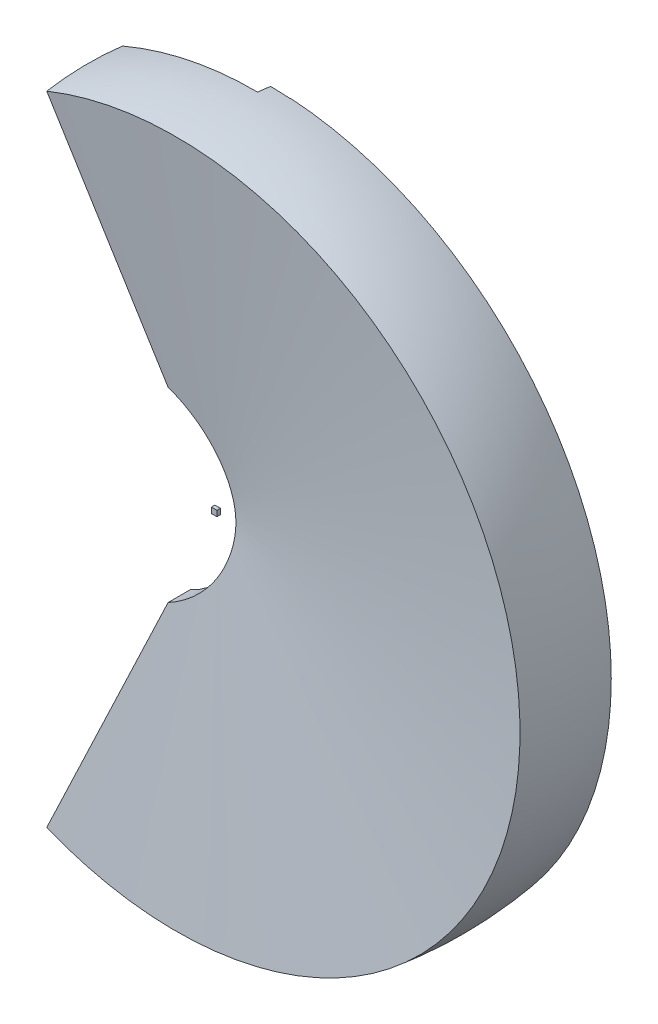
SolidWorks part; units mm, degrees
ref_plane "Piano frontale" through (0, 0, 0) normal (0, 0, 1) x (1, 0, 0)
ref_plane "Piano superiore" through (0, 0, 0) normal (0, 1, 0) x (1, 0, 0)
ref_plane "Piano destro" through (0, 0, 0) normal (1, 0, 0) x (0, 0, -1)
sketch "Schizzo1" plane through (0, 0, 0) normal (0, 0, 1) x (1, 0, 0)
  line L1 (-32.5, 32.5) -> (32.5, 32.5)
  line L2 (-32.5, 32.5) -> (-32.5, -32.5)
  line L3 (-32.5, -32.5) -> (32.5, -32.5)
  line L4 (32.5, 32.5) -> (32.5, -32.5)
  line L5 (-32.5, 32.5) -> (32.5, -32.5) construction
  line L6 (-32.5, -32.5) -> (32.5, 32.5) construction
  point P0 (0, 0)
  dimension "D1" = 65
extrude "Estrusione-Estrusione1" add sketch "Schizzo1" along normal blind 39.5
ref_plane "Piano1" through (0, 0, -60.5) normal (0, 0, -1) x (-1, 0, 0)
ref_plane "Piano2" through (0, 0, -585.3) normal (0, 0, -1) x (-1, 0, 0)
ref_plane "Piano3" through (-202.66, 0, 0) normal (-1, 0, 0) x (0, 0, 1)
ref_plane "Piano4" through (0, -500, 0) normal (0, -1, 0) x (-1, 0, 0)
ref_plane "Piano7" through (0, 0, 139.5) normal (0, 0, 1) x (1, 0, 0)
ref_plane "Piano5" through (32.5, 0, 0) normal (1, 0, 0) x (0, 0, -1)
sketch "Schizzo2" plane through (0, 0, 0) normal (0, 1, 0) x (1, 0, 0)
  line L0 (0, 0) -> (0, 20.5)
  line L1 (0, 20.5) -> (12.48, 20.5)
  line L2 (0, 0) -> (24, 0)
  line L3 (32.5, 0) -> (-32.5, 0) construction
  line L5 (32.5, -39.5) -> (-32.5, -39.5) construction
  arc A0 (24, 0) -> (12.48, 20.5) centre (0, 0) ccw
  dimension "D1" = 60
  dimension "D2" = 24
revolve "Rivoluzione1" add sketch "Schizzo2" angle 360 about L0
sketch "Schizzo4" plane through (0, 0, 0) normal (0, 1, 0) x (1, 0, 0)
  line L0 (32.5, -39.5) -> (-32.5, -39.5) construction
  line L1 (0, -992.5) -> (0, 49007.5) construction
  point P0 (0, 7.5)
  dimension "D1" = 47
sketch "Schizzo13" plane through (0, 0, 0) normal (0, 1, 0) x (1, 0, 0)
  line L0 (0, 7.5) -> (451.4268, 585.3) construction
  line L1 (32.5, 0) -> (-32.5, 0) construction
  line L2 (35.75, 585.3) -> (-35.75, 585.3) construction
  dimension "D1" = 52
ref_point "Punto1"
sketch "Schizzo5" plane through (0, 0, 0) normal (0, 1, 0) x (1, 0, 0)
  line L2 (-999.5584, 7.5) -> (49000.4416, 7.5) construction
  line L3 (0, -992.5) -> (0, 49007.5) construction
  line L4 (20.1593, 33.3027) -> (2462.6459, 3159.543) construction
  line L5 (0, 7.5) -> (2462.6459, 3159.543) construction
  line L7 (0, 7.5) -> (3970.1846, -479.9774) construction
  line L8 (32.5, 3.5095) -> (3970.1846, -479.9774)
  line L11 (20.1593, 33.3027) -> (451.4268, 585.3)
  line L12 (451.4268, 585.3) -> (3958.0484, 585.3)
  line L13 (35.75, 585.3) -> (-35.75, 585.3) construction
  arc A0 (3970.1846, -479.9774) -> (2462.6459, 3159.543) centre (0, 7.5) ccw construction
  arc A1 (32.5, 3.5095) -> (20.1593, 33.3027) centre (0, 7.5) ccw
  arc A2 (3970.1846, -479.9774) -> (3958.0484, 585.3) centre (0, 7.5) ccw
  point P11 (4000, 7.5)
  dimension "D1" = 52
  dimension "D2" = 4000
  dimension "D4" = 7
revolve "Rivoluzione5" add sketch "Schizzo5" angle 360 about L3
sketch "Schizzo8" plane through (32.5, 0, 0) normal (1, 0, 0) x (0, 0, -1)
  line L0 (585.3, -35.75) -> (585.3, 35.75) construction
  line L1 (-814.7, 500) -> (-39.5, 500)
  line L2 (-814.7, 500) -> (-814.7, -500)
  line L3 (-814.7, -500) -> (-39.5, -500)
  line L4 (585.3, 500) -> (585.3, -500)
  line L5 (-814.7, 500) -> (585.3, -500) construction
  line L6 (-814.7, -500) -> (585.3, 500) construction
  line L9 (-39.5, -500) -> (-39.5, 500)
  line L10 (-39.5, -32.5) -> (-39.5, 32.5) construction
  line L11 (60.5, 500) -> (60.5, -500)
  line L12 (60.5, -35.75) -> (60.5, 35.75) construction
  line L13 (60.5, -500) -> (585.3, -500)
  line L14 (60.5, 500) -> (585.3, 500)
  point P0 (-114.7, 0)
  point P10 (-39.5, 0)
  point P21 (60.5, 0)
  dimension "D1" = 1400
  dimension "D2" = 1000
extrude "Taglio-Estrusione4" cut sketch "Schizzo8" along direction (1, 0, 0) on the side against the normal up to next
sketch3d "Schizzo3D1"
  line L0 (0, 0, -7.5) -> (-181.9851, -500, -7.5) construction
  line L1 (-181.9851, -500, -7.5) -> (0, -500, -7.5) construction
  line L2 (0, -500, -7.5) -> (0, 0, -7.5) construction
  line L3 (-32.5, 32.5, 39.5) -> (-32.5, -32.5, 39.5) construction
  line L4 (-32.5, -32.5, 39.5) -> (32.5, -32.5, 39.5) construction
  line L5 (0, 0, -7.5) -> (0, 0, -60.5) construction
  line L6 (0, 0, 992.5) -> (0, 0, -49007.5) construction
  line L10 (32.5, 0, -60.5) -> (0, 0, -7.5) construction
  line L13 (32.5, -500, -60.5) -> (32.5, 0, -60.5) construction
  line L14 (0, 0, -60.5) -> (32.5, -500, -60.5)
  line L22 (32.5, -500, -60.5) -> (0, 0, -7.5) construction
  line L23 (0, 0, -60.5) -> (32.5, 0, -60.5)
  line L24 (32.5, -500, -60.5) -> (32.5, 0, -60.5)
  dimension "D1" = 20
  dimension "D2" = 500
sketch "Schizzo11" plane through (0, 0, 0) normal (0, 1, 0) x (1, 0, 0)
  line L0 (35.75, 585.3) -> (-35.75, 585.3) construction
  line L1 (0, -514.7) -> (-40000, -514.7)
  line L2 (0, -514.7) -> (0, -39.5)
  line L3 (0, 585.3) -> (-40000, 585.3)
  line L4 (-40000, -514.7) -> (-40000, 585.3)
  line L9 (0, 60.5) -> (-202.66, 60.5)
  line L11 (-202.66, -39.5) -> (-202.66, 60.5)
  line L12 (32.5, -39.5) -> (-32.5, -39.5) construction
  line L13 (0, -39.5) -> (-202.66, -39.5)
  line L14 (0, 60.5) -> (0, 585.3)
  line L16 (-202.66, 21.725) -> (-202.66, -21.725) construction
  line L17 (35.75, 60.5) -> (-35.75, 60.5) construction
  dimension "D1" = 40000
  dimension "D2" = 1100
revolve "Taglia-Rivoluzione1" cut sketch "Schizzo11" angle 135.87 mid plane about L1
sketch "Schizzo12" plane through (32.5, 0, 0) normal (1, 0, 0) x (0, 0, -1)
  line L0 (7.5, 0) -> (60.5, -500) construction
  line L2 (0, -32.5) -> (0, 32.5) construction
  line L3 (60.5, -500) -> (585.3, -5450.9434)
  line L4 (585.3, -5450.9434) -> (585.3, 5450.9422)
  line L6 (585.3, -35.75) -> (585.3, 35.75) construction
  line L7 (60.5, -500) -> (60.5, 499.9988)
  line L11 (60.5, 499.9988) -> (585.3, 5450.9422)
  dimension "D1" = 502.8012
  dimension "D2" = 6.051
  dimension "D3" = 6.051
  dimension "D4" = 502.8
extrude "Taglio-Estrusione8" cut sketch "Schizzo12" against normal up to next
sketch "Schizzo15" plane through (0, 0, 0) normal (1, 0, 0) x (0, 0, -1)
  line L0 (60.5, 0) -> (585.3, 0)
  line L1 (-200992.5, 0) -> (249007.5, 0) construction
  line L2 (585.3, 0) -> (585.3, -4000)
  line L4 (60.5, -35.75) -> (60.5, 35.75) construction
  line L5 (585.3, -35.75) -> (585.3, 35.75) construction
  line L6 (7.5, 0) -> (60.2315, -500.0272) construction
  line L9 (60.2315, -500.0272) -> (585.3, -4000)
  line L11 (0, -32.5) -> (0, 32.5) construction
  line L12 (60.5, 0) -> (60.2315, -500.0272)
  dimension "D1" = 6.02
  dimension "D2" = 502.8
  dimension "D3" = 4000
revolve "Taglia-Rivoluzione3" cut sketch "Schizzo15" angle 3.72 about L1
sketch "Schizzo16" plane through (0, 0, -585.3) normal (0, 0, -1) x (-1, 0, 0)
  circle A0 centre (967.5, 0) radius 1200
  dimension "D1" = 2400
  dimension "D2" = 967.5
extrude "Taglio-Estrusione11" cut sketch "Schizzo16" against normal up to next
mirror "Specchia2" about plane through (0, 0, 0) normal (0, 1, 0) of "Taglia-Rivoluzione3"
